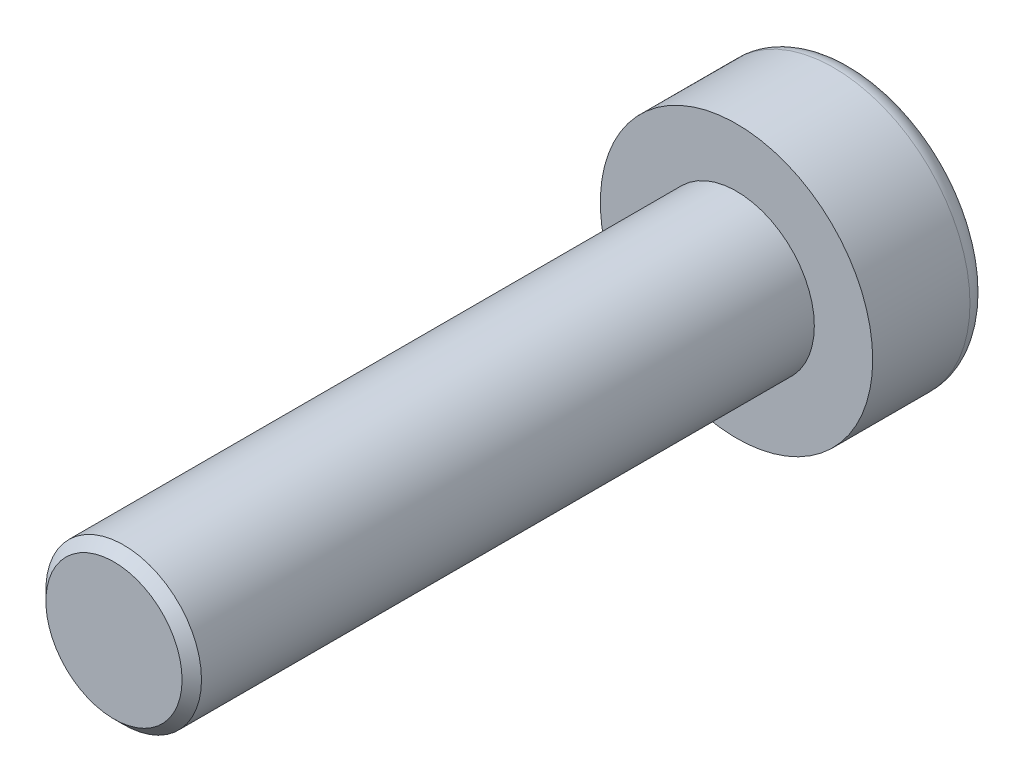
SolidWorks part; units mm, degrees
ref_plane "Plan1" through (0, 0, 0) normal (0, 0, 1) x (1, 0, 0)
ref_plane "Plan2" through (0, 0, 0) normal (0, 1, 0) x (1, 0, 0)
ref_plane "Plan3" through (0, 0, 0) normal (1, 0, 0) x (0, 0, -1)
sketch "Esquisse1" plane through (0, 0, 0) normal (0, 0, 1) x (1, 0, 0)
  circle A0 centre (0, 0) radius 3.5
  dimension "D1" = 7
extrude "Base-Extrusion" add sketch "Esquisse1" along normal blind 3
sketch "Esquisse2" plane through (0, 0, 3) normal (0, 0, 1) x (1, 0, 0)
  circle A0 centre (0, 0) radius 2
  dimension "D1" = 4
extrude "Boss.-Extru.1" add sketch "Esquisse2" along normal blind 16
chamfer "Chanfrein1" distance 0.25 angle 45
fillet "Congé1" radius 0.5
